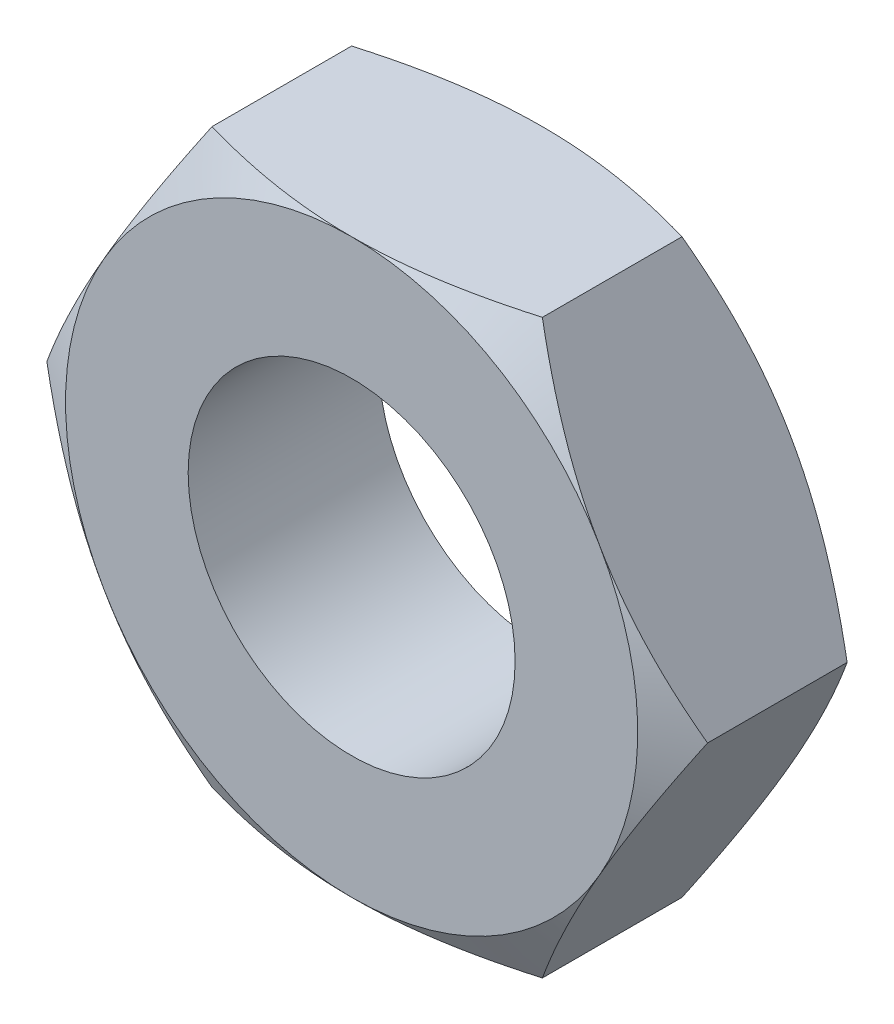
SolidWorks part; units mm, degrees
ref_plane "Plan1" through (0, 0, 0) normal (0, 0, 1) x (1, 0, 0)
ref_plane "Plan2" through (0, 0, 0) normal (0, 1, 0) x (1, 0, 0)
ref_plane "Plan3" through (0, 0, 0) normal (1, 0, 0) x (0, 0, -1)
sketch "Esquisse1" plane through (0, 0, 0) normal (0, 0, 1) x (1, 0, 0)
  line L3 (6.0622, -10.5) -> (12.1244, 0)
  line L4 (12.1244, 0) -> (6.0622, 10.5)
  line L5 (6.0622, 10.5) -> (-6.0622, 10.5)
  line L6 (-6.0622, 10.5) -> (-12.1244, 0)
  line L7 (-12.1244, 0) -> (-6.0622, -10.5)
  line L8 (-6.0622, -10.5) -> (6.0622, -10.5)
  circle A0 centre (0, 0) radius 12.1244 construction
  dimension "D3" = 21
extrude "Base-Extrusion" add sketch "Esquisse1" along normal mid plane 7
sketch "Esquisse5" plane through (0, 0, 0) normal (1, 0, 0) x (0, 0, -1)
  line L0 (3.5, -10.5) -> (-1.75, -19.5933)
  line L1 (0, 0) -> (-3.5, 0) construction
  line L2 (-1.75, 0) -> (-1.75, 8.6587) construction
  dimension "D1" = 60
other "Enlèv. de mat.-Révol.-Mince1" parameters "D1"=360, "D3"=1, "D4"=1, "D7"=0
mirror "Symétrie1" about plane through (0, 0, 0) normal (0, 0, 1)
sketch "Esquisse4" plane through (0, 0, 3.5) normal (0, 0, 1) x (1, 0, 0)
  circle A0 centre (0, 0) radius 6
  dimension "D1" = 12
extrude "Enlèv. mat.-Extru.1" cut sketch "Esquisse4" against normal through all
equation "\"D1@Base-Extrusion\" = 0.5*\"D2@Représentation de filetage1\""
